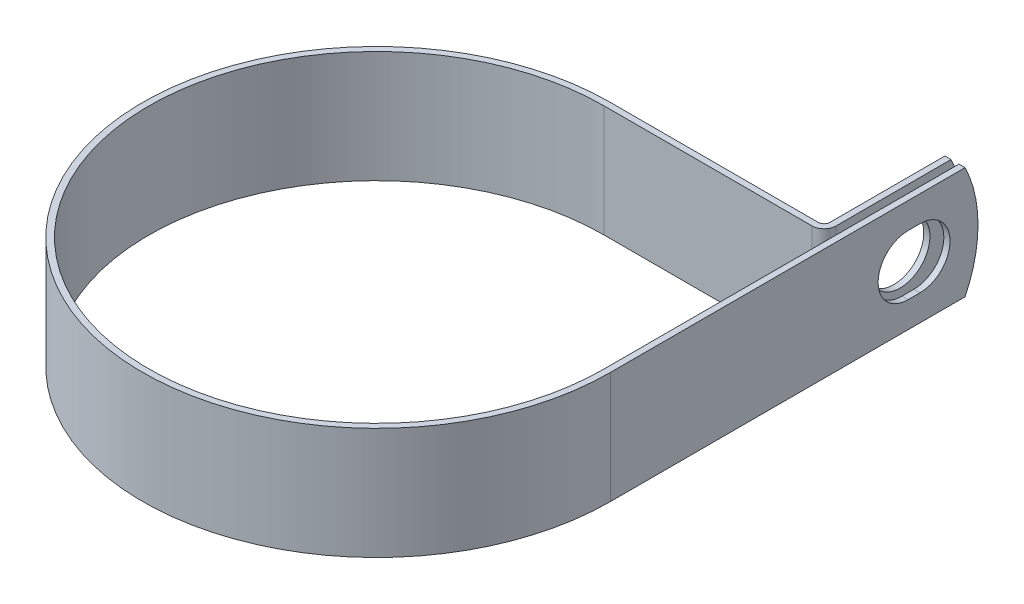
SolidWorks part; units mm, degrees
ref_plane "Front Plane" through (0, 0, 0) normal (0, 0, 1) x (1, 0, 0)
ref_plane "Top Plane" through (0, 0, 0) normal (0, 1, 0) x (1, 0, 0)
ref_plane "Right Plane" through (0, 0, 0) normal (1, 0, 0) x (0, 0, -1)
sketch "Sketch1" plane through (0, 0, 0) normal (0, 1, 0) x (1, 0, 0)
  line L0 (0, 45.2374) -> (41.2852, 45.2374)
  line L1 (45.2374, 0) -> (45.2374, 45.2374)
  line L2 (43.6626, 73.025) -> (43.6626, 47.6148)
  line L5 (45.2374, 45.2374) -> (45.2374, 73.025)
  arc A0 (0, 45.2374) -> (45.2374, 0) centre (0, 0) ccw
  arc A3 (41.2852, 45.2374) -> (43.6626, 47.6148) centre (41.2852, 47.6148) ccw
extrude "Extrude-Thin1" add sketch "Sketch1" along normal mid plane 22.225 thin
sketch "Sketch2" plane through (42.4434, 0, 0) normal (-1, 0, 0) x (0, 0, 1)
  line L0 (-73.025, 11.1125) -> (-73.025, -11.1125) construction
  line L7 (0, 11.1125) -> (0, -11.1125) construction
  circle A0 centre (-60.325, 0) radius 5.9436
  point P2 (-73.025, 0)
extrude "Cut-Extrude1" cut sketch "Sketch2" against normal up to surface (1.2192 mm away)
sketch "Sketch3" plane through (46.4566, 0, 0) normal (1, 0, 0) x (0, 0, -1)
  line L0 (59.1312, 0) -> (61.5188, 0) construction
  line L1 (59.1312, 5.9436) -> (61.5188, 5.9436)
  line L2 (59.1312, -5.9436) -> (61.5188, -5.9436)
  line L3 (73.025, 11.1125) -> (73.025, -11.1125) construction
  arc A0 (59.1312, 5.9436) -> (59.1312, -5.9436) centre (59.1312, 0) ccw
  arc A1 (61.5188, -5.9436) -> (61.5188, 5.9436) centre (61.5188, 0) ccw
  point P3 (60.325, 0)
  point P8 (73.025, 0)
  point P11 (53.1876, 0)
  point P12 (67.4624, 0)
extrude "Cut-Extrude2" cut sketch "Sketch3" against normal up to surface (1.2192 mm away)
sketch "Sketch4" plane through (42.4434, 0, 0) normal (-1, 0, 0) x (0, 0, 1)
  line L0 (-73.025, 11.1125) -> (-73.025, -11.1125)
  line L1 (-73.025, 11.1125) -> (-70.4651, 11.1125)
  line L2 (-73.025, 11.1125) -> (-47.6148, 11.1125) construction
  line L3 (-73.025, -11.1125) -> (-70.4651, -11.1125)
  line L4 (-73.025, -11.1125) -> (-47.6148, -11.1125) construction
  arc A0 (-70.4651, 11.1125) -> (-70.4651, -11.1125) centre (-47.625, 0) ccw
extrude "Cut-Extrude3" cut sketch "Sketch4" against normal through all contours A0 M4 M5 | A0 L0 M2
equation "\"D1@Sketch3\" = \"D2@Sketch2\""
equation "\"D7@Sketch1\" = \"D3@Sketch2\" + \"D1@Sketch3\""
equation "\"D1@Sketch4\" = ( \"D1@Extrude-Thin1\" + .125 ) * 2"
equation "\"D2@Sketch1\"=1.95*\"D5@Extrude-Thin1\""
equation "\"D2@Sketch3\" = \"D1@Sketch2\""
